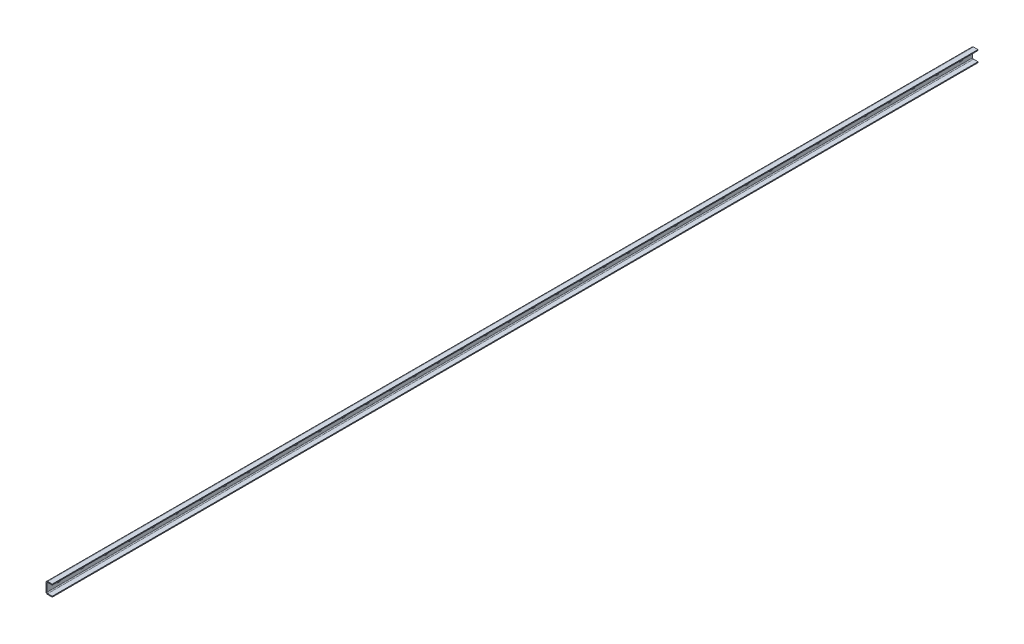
SolidWorks part; units mm, degrees
ref_plane "Front Plane" through (0, 0, 0) normal (0, 0, 1) x (1, 0, 0)
ref_plane "Top Plane" through (0, 0, 0) normal (0, 1, 0) x (1, 0, 0)
ref_plane "Right Plane" through (0, 0, 0) normal (1, 0, 0) x (0, 0, -1)
sketch "Sketch1" plane through (0, 0, 0) normal (0, 0, 1) x (1, 0, 0)
  line L0 (21, 16.25) -> (21, 19.25)
  line L1 (21, 19.25) -> (6, 19.25)
  line L2 (0, 13.25) -> (0, 0)
  line L3 (0, 0) -> (0, -13.25)
  line L4 (6, -19.25) -> (21, -19.25)
  line L5 (21, -19.25) -> (21, -16.25)
  line L6 (21, -16.25) -> (6, -16.25)
  line L7 (3, -13.25) -> (3, 13.25)
  line L8 (6, 16.25) -> (21, 16.25)
  arc A0 (6, 19.25) -> (0, 13.25) centre (6, 13.25) ccw
  arc A1 (0, -13.25) -> (6, -19.25) centre (6, -13.25) ccw
  arc A2 (6, -16.25) -> (3, -13.25) centre (6, -13.25) cw
  arc A3 (3, 13.25) -> (6, 16.25) centre (6, 13.25) cw
  dimension "D1" = 6
  dimension "D2" = 21
  dimension "D3" = 16.25
extrude "Boss-Extrude1" add sketch "Sketch1" against normal blind 3120 contours L7 A3 L8 L0 L1 A0 L2 L3 A1 L4 L5 L6 A2
sketch "Sketch2" plane through (3, 0, 0) normal (1, 0, 0) x (0, 0, -1)
  line L0 (38, 0) -> (42, 0) construction
  line L1 (38, 4.5) -> (42, 4.5)
  line L2 (38, -4.5) -> (42, -4.5)
  arc A0 (38, 4.5) -> (38, -4.5) centre (38, 0) ccw
  arc A1 (42, -4.5) -> (42, 4.5) centre (42, 0) ccw
  point P2 (40, 0)
  point P8 (40, -4.5)
  point P9 (40, 4.5)
  dimension "D1" = 4
  dimension "D2" = 9
  dimension "D3" = 40
extrude "Cut-Extrude1" cut sketch "Sketch2" against normal through all
pattern_linear "LPattern1" count 39 spacing 80 along (0, 0, -1) of "Cut-Extrude1"
